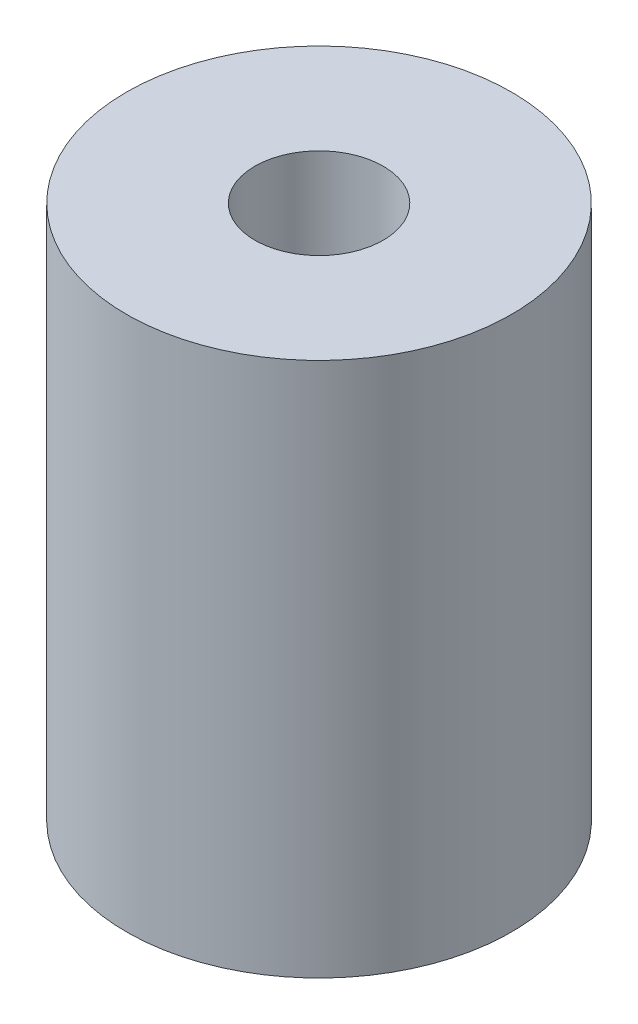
SolidWorks part; units mm, degrees
ref_plane "Front Plane" through (0, 0, 0) normal (0, 0, 1) x (1, 0, 0)
ref_plane "Top Plane" through (0, 0, 0) normal (0, 1, 0) x (1, 0, 0)
ref_plane "Right Plane" through (0, 0, 0) normal (1, 0, 0) x (0, 0, -1)
sketch "Sketch1" plane through (0, 0, 0) normal (0, 0, 1) x (1, 0, 0)
  line L0 (3, 0) -> (9, 0)
  line L1 (0, 25) -> (0, 0) construction
  line L3 (9, 25) -> (9, 0)
  line L4 (3, 25) -> (3, 0)
  line L8 (3, 25) -> (9, 25)
  dimension "D1" = 3
  dimension "D2" = 25
  dimension "D3" = 6
revolve "Revolve1" add sketch "Sketch1" angle 360 about L1
